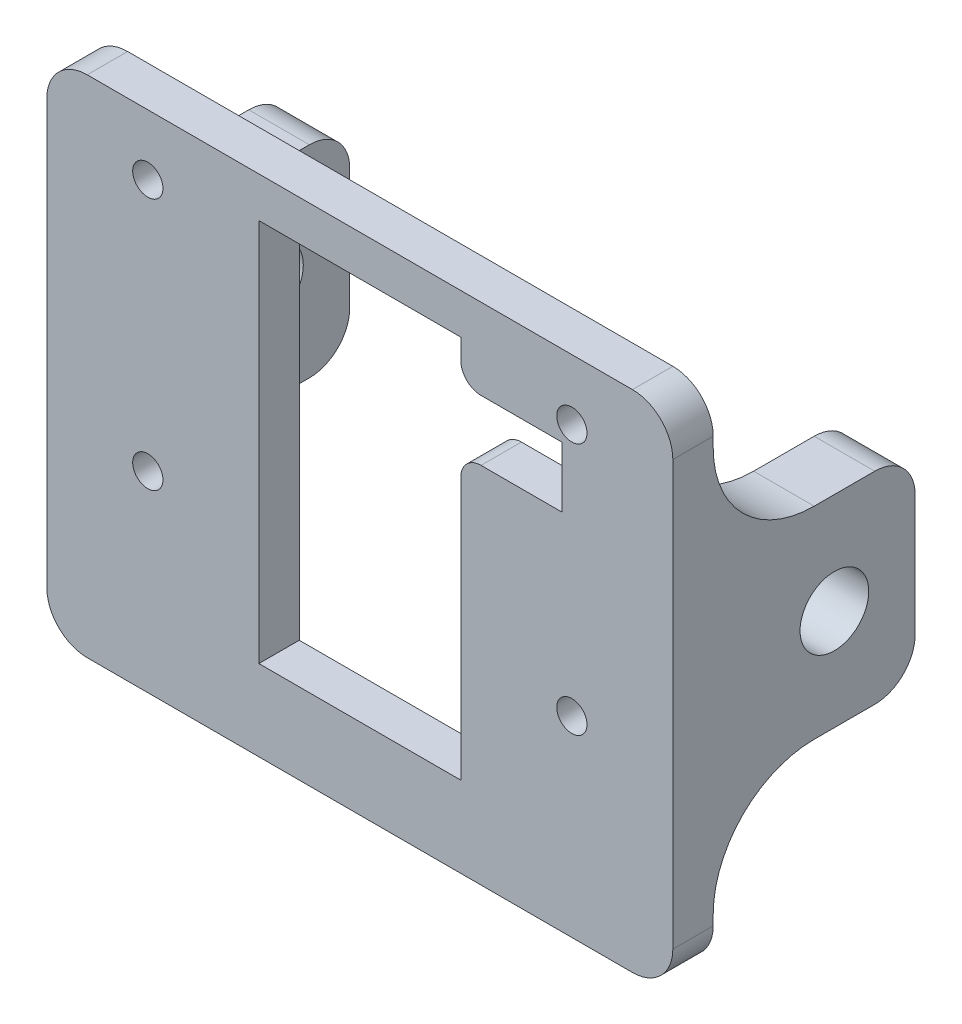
SolidWorks part; units mm, degrees
ref_plane "Plan de face" through (0, 0, 0) normal (0, 0, 1) x (1, 0, 0)
ref_plane "Plan de dessus" through (0, 0, 0) normal (0, 1, 0) x (1, 0, 0)
ref_plane "Plan de droite" through (0, 0, 0) normal (1, 0, 0) x (0, 0, -1)
sketch "Esquisse1" plane through (0, 0, 0) normal (0, 0, 1) x (1, 0, 0)
  line L0 (0, 0) -> (0, -4.8492) construction
  line L1 (-15.5, 12.5) -> (15.5, 12.5)
  line L2 (-15.5, 12.5) -> (-15.5, -12.5)
  line L3 (-15.5, -12.5) -> (15.5, -12.5)
  line L4 (15.5, 12.5) -> (15.5, -12.5)
  line L5 (0, 0) -> (5.7449, 0) construction
  dimension "D1" = 31
  dimension "D2" = 25
extrude "Boss.-Extru.1" add sketch "Esquisse1" along normal blind 2
sketch "Esquisse2" plane through (0, 0, 2) normal (0, 0, 1) x (1, 0, 0)
  line L0 (0, 0) -> (0, 2.8376) construction
  line L1 (15.5, 12.5) -> (-15.5, 12.5) construction
  circle A0 centre (-10.5, 9.5) radius 0.75
  circle A1 centre (-10.5, -3) radius 0.75
  circle A2 centre (10.5, -3) radius 0.75
  circle A3 centre (10.5, 9.5) radius 0.75
  dimension "D1" = 1.5
  dimension "D2" = 21
  dimension "D3" = 21
  dimension "D4" = 12.5
  dimension "D5" = 3
extrude "Enlèv. mat.-Extru.1" cut sketch "Esquisse2" against normal up to next
sketch "Esquisse3" plane through (0, 0, 2) normal (0, 0, 1) x (1, 0, 0)
  line L0 (0, 0) -> (0, 4.3625) construction
  line L1 (-5, 10.5) -> (5, 10.5)
  line L2 (-5, 10.5) -> (-5, -8.5)
  line L3 (-5, -8.5) -> (5, -8.5)
  line L4 (5, 10.5) -> (5, -8.5)
  line L5 (15.5, 12.5) -> (-15.5, 12.5) construction
  dimension "D1" = 10
  dimension "D2" = 2
  dimension "D3" = 19
extrude "Enlèv. mat.-Extru.2" cut sketch "Esquisse3" against normal up to next
sketch "Esquisse6" plane through (0, 0, 2) normal (0, 0, 1) x (1, 0, 0)
  line L0 (5, -8.5) -> (5, 10.5) construction
  line L1 (5, 8.5) -> (10, 8.5)
  line L2 (5, 8.5) -> (5, 5.5)
  line L3 (5, 5.5) -> (10, 5.5)
  line L4 (10, 8.5) -> (10, 5.5)
  line L7 (15.5, 12.5) -> (-15.5, 12.5) construction
  point P8 (7.5, 8.5)
  dimension "D1" = 4
  dimension "D2" = 3
  dimension "D3" = 5
extrude "Enlèv. mat.-Extru.3" cut sketch "Esquisse6" against normal up to next
sketch "Esquisse7" plane through (0, 0, 0) normal (0, 0, -1) x (-1, 0, 0)
  line L0 (15.5, 12.5) -> (15.5, -12.5) construction
  line L1 (15.5, 5) -> (12.5, 5)
  line L2 (15.5, 5) -> (15.5, -5)
  line L3 (15.5, -5) -> (12.5, -5)
  line L4 (12.5, 5) -> (12.5, -5)
  line L5 (-15.5, -12.5) -> (-15.5, 12.5) construction
  line L6 (-15.5, 5) -> (-12.5, 5)
  line L7 (-15.5, 5) -> (-15.5, -5)
  line L8 (-15.5, -5) -> (-12.5, -5)
  line L9 (-12.5, 5) -> (-12.5, -5)
  line L10 (-15.5, 12.5) -> (15.5, 12.5) construction
  dimension "D1" = 3
  dimension "D2" = 10
  dimension "D3" = 7.5
extrude "Boss.-Extru.2" add sketch "Esquisse7" along normal blind 10
fillet "Congé1" radius 5 4 edges at (14, 5, 0) (-14, 5, 0) (-14, -5, 0) (14, -5, 0)
fillet "Congé2" radius 2 4 edges at (14, -5, -10) (-14, -5, -10) (-14, 5, -10) (14, 5, -10)
sketch "Esquisse8" plane through (15.5, 0, 0) normal (1, 0, 0) x (0, 0, -1)
  line L0 (-2, -12.5) -> (-2, 12.5) construction
  line L1 (8, 5) -> (5, 5) construction
  circle A0 centre (6, 0) radius 1.7
  point P6 (6.5, 5)
  dimension "D2" = 3.4
  dimension "D1" = 8
  dimension "D3" = 5
extrude "Enlèv. mat.-Extru.4" cut sketch "Esquisse8" against normal through all
fillet "Congé3" radius 2 4 edges at (15.5, -12.5, 1) (-15.5, -12.5, 1) (15.5, 12.5, 1) (-15.5, 12.5, 1)
fillet "Congé4" radius 1 2 edges at (5, 8.5, 1) (5, 5.5, 1)
